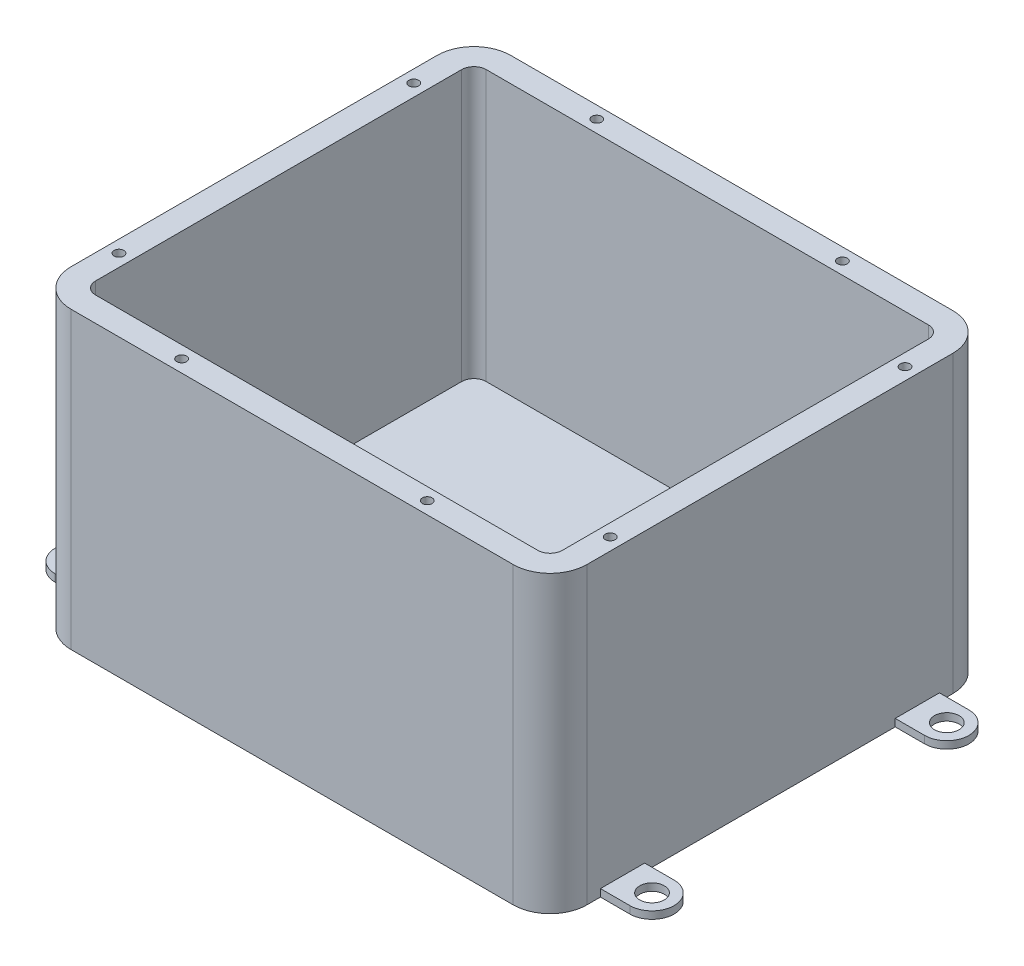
SolidWorks part; units mm, degrees
ref_plane "Front Plane" through (0, 0, 0) normal (0, 0, 1) x (1, 0, 0)
ref_plane "Top Plane" through (0, 0, 0) normal (0, 1, 0) x (1, 0, 0)
ref_plane "Right Plane" through (0, 0, 0) normal (1, 0, 0) x (0, 0, -1)
sketch "Sketch1" plane through (0, 0, 0) normal (0, 1, 0) x (1, 0, 0)
  line L1 (-90, -89.5) -> (90, -89.5)
  line L2 (-105, -74.5) -> (-105, 74.5)
  line L3 (-90, 89.5) -> (90, 89.5)
  line L4 (105, -74.5) -> (105, 74.5)
  line L5 (-105, -89.5) -> (105, 89.5) construction
  line L6 (-105, 89.5) -> (105, -89.5) construction
  arc A0 (-105, -74.5) -> (-90, -89.5) centre (-90, -74.5) ccw
  arc A1 (90, -89.5) -> (105, -74.5) centre (90, -74.5) ccw
  arc A2 (105, 74.5) -> (90, 89.5) centre (90, 74.5) ccw
  arc A3 (-105, 74.5) -> (-90, 89.5) centre (-90, 74.5) cw
  point P0 (0, 0)
  dimension "D3" = 15
  dimension "D1" = 179
  dimension "D2" = 210
extrude "Boss-Extrude1" add sketch "Sketch1" along normal blind 225
shell "Shell1" thickness 10
fillet "Fillet1" radius 15 8 edges at (100.6066, 225, -85.1066) (105, 225, 0) (100.6066, 225, 85.1066) (0, 225, 89.5) (-100.6066, 225, 85.1066) (-105, 225, 0) (-100.6066, 225, -85.1066) (0, 225, -89.5)
ref_plane "Plane1" through (0, 0, 0) normal (0, 1, 0) x (1, 0, 0)
sketch "Sketch2" plane through (0, 0, 0) normal (0, 1, 0) x (1, 0, 0)
  line L0 (0, 164.0047) -> (0, -138.9146) construction
  line L1 (-50, 164.0047) -> (-50, -138.9146) construction
  line L7 (-107.4729, 0) -> (123.6536, 0) construction
  line L8 (-121.2105, 60) -> (123.6536, 60) construction
  line L9 (-117, 51) -> (-105, 51)
  line L10 (-105, -74.5) -> (-105, 74.5) construction
  line L11 (-105, 51) -> (-105, 69)
  line L12 (-105, 69) -> (-117, 69)
  line L25 (-105, -69) -> (-117, -69)
  line L26 (-105, -51) -> (-105, -69)
  line L27 (-117, -51) -> (-105, -51)
  line L28 (117, -51) -> (105, -51)
  line L29 (105, -51) -> (105, -69)
  line L30 (105, -69) -> (117, -69)
  line L31 (105, 69) -> (117, 69)
  line L32 (105, 51) -> (105, 69)
  line L33 (117, 51) -> (105, 51)
  circle A2 centre (-117, 60) radius 5
  arc A3 (-117, 69) -> (-117, 51) centre (-117, 60) ccw
  arc A10 (-117, -69) -> (-117, -51) centre (-117, -60) cw
  circle A11 centre (-117, -60) radius 5
  circle A12 centre (117, -60) radius 5
  arc A13 (117, -69) -> (117, -51) centre (117, -60) ccw
  arc A14 (117, 69) -> (117, 51) centre (117, 60) cw
  circle A15 centre (117, 60) radius 5
  point P61 (59, 89.5)
  dimension "D6" = 10
  dimension "D7" = 18
  dimension "D1" = 50
  dimension "D5" = 60
  dimension "D8" = 12
extrude "Boss-Extrude2" add sketch "Sketch2" along normal blind 3
ref_plane "Plane2" through (0, 120, 0) normal (0, 1, 0) x (1, 0, 0)
other "SurfaceCut1"
sketch "Sketch3" plane through (0, 120, 0) normal (0, 1, 0) x (1, 0, 0)
  line L0 (-50, 101.5) -> (-50, -101.5) construction
  line L1 (0, 141.2272) -> (0, -146.6848) construction
  line L2 (-152.3836, 0) -> (163.1785, 0) construction
  line L5 (90, 79.5) -> (-90, 79.5) construction
  line L6 (-117, 60) -> (117, 60) construction
  line L7 (-105, 74.5) -> (-105, -74.5) construction
  circle A1 centre (-50, 84.5) radius 2
  circle A2 centre (50, 84.5) radius 2
  circle A3 centre (-50, -84.5) radius 2
  circle A4 centre (50, -84.5) radius 2
  circle A5 centre (-100, 60) radius 2
  circle A6 centre (-100, -60) radius 2
  circle A7 centre (100, -60) radius 2
  circle A8 centre (100, 60) radius 2
  point P34 (0, 0)
  dimension "D1" = 4
  dimension "D3" = 4
  dimension "D2" = 5
  dimension "D4" = 5
extrude "Cut-Extrude2" cut sketch "Sketch3" against normal blind 20
